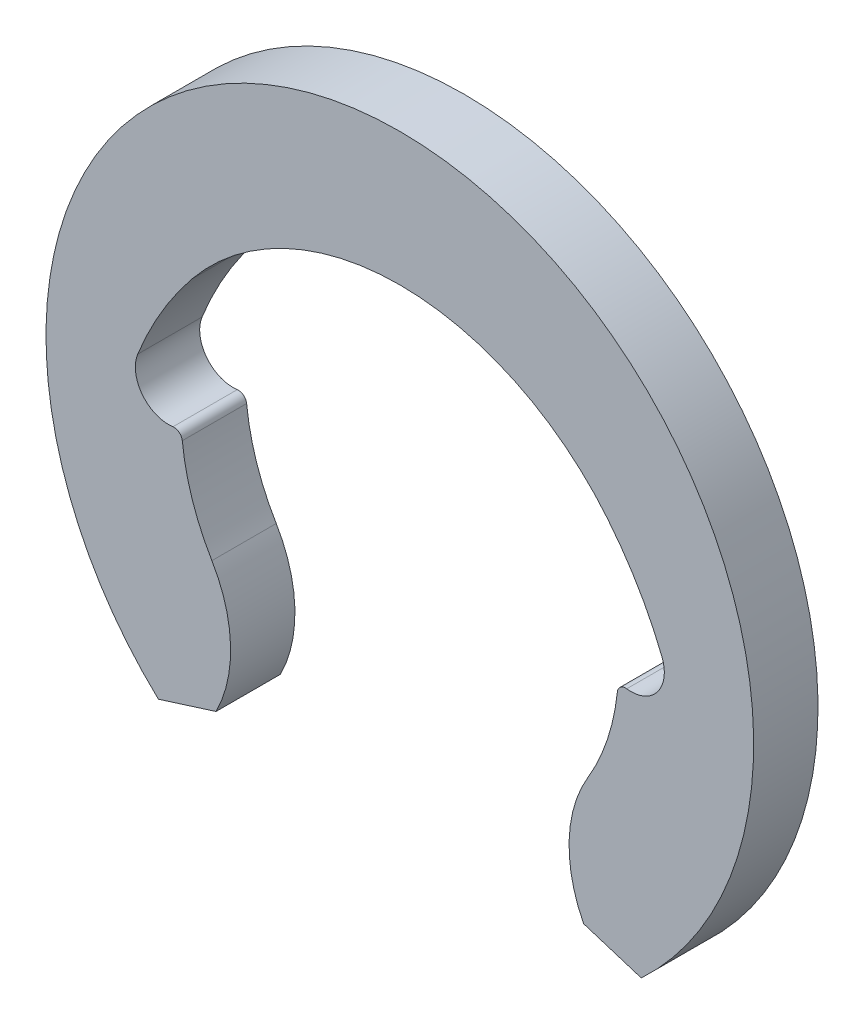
SolidWorks part; units mm, degrees
ref_plane "Front Plane" through (0, 0, 0) normal (0, 0, 1) x (1, 0, 0)
ref_plane "Top Plane" through (0, 0, 0) normal (0, 1, 0) x (1, 0, 0)
ref_plane "Right Plane" through (0, 0, 0) normal (1, 0, 0) x (0, 0, -1)
sketch "Sketch1" plane through (0, 0, 0) normal (0, 0, 1) x (1, 0, 0)
  line L0 (2.4748, 0) -> (-2.7989, 0) construction
  line L1 (0, 2.5848) -> (0, -2.932) construction
  line L2 (0, -0.2095) -> (0, 0.2095) construction
  line L3 (-1.0885, -1.4242) -> (-1.4299, -1.5318)
  line L4 (1.0885, -1.4242) -> (1.4299, -1.5318)
  arc A0 (-1.2883, -0.1352) -> (-1.113, -0.6628) centre (0, 0) ccw
  arc A1 (1.4299, -1.5318) -> (-1.4299, -1.5318) centre (0, 0) ccw
  arc A2 (-1.5524, 0.1766) -> (-1.3437, -0.0916) centre (-1.3696, 0.1036) ccw
  arc A3 (-1.5524, 0.1766) -> (-1.2303, 0.7238) centre (0.3937, -0.6004) cw
  arc A4 (1.5524, 0.1766) -> (1.2303, 0.7238) centre (-0.3937, -0.6004) ccw
  arc A5 (1.113, -0.6628) -> (1.2883, -0.1352) centre (0, 0) ccw
  arc A6 (-1.113, -0.6628) -> (-1.0885, -1.4242) centre (-1.7895, -1.0656) cw
  arc A7 (-1.2883, -0.1352) -> (-1.3437, -0.0916) centre (-1.3373, -0.1404) ccw
  arc A8 (1.113, -0.6628) -> (1.0885, -1.4242) centre (1.7895, -1.0656) ccw
  arc A9 (1.2883, -0.1352) -> (1.3437, -0.0916) centre (1.3373, -0.1404) cw
  arc A10 (1.5524, 0.1766) -> (1.3437, -0.0916) centre (1.3696, 0.1036) cw
  arc A11 (1.2303, 0.7238) -> (-1.2303, 0.7238) centre (0, -0.2794) ccw
  circle A12 centre (0, 0) radius 1.2954 construction
  dimension "D1" = 0.0492
  dimension "D2" = 2.0955
  dimension "D3" = 0.7874
  dimension "D4" = 0.1968
  dimension "Free_Outside_Dia" = 4.191
  dimension "Diameter" = 2.5908
  dimension "D5" = 2.7392
  dimension "D6" = 0.7874
  dimension "Shaft" = 3.175
  dimension "Large_Section" = 0.7874
  dimension "D7" = 3.5791
  dimension "D8" = 0.3579
  dimension "D9" = 145
extrude "Extrude1" add sketch "Sketch1" along normal mid plane 0.381
equation "\"D3@Sketch1\" = \"Large_Section@Sketch1\""
equation "\"D6@Sketch1\" = \"Large_Section@Sketch1\""
equation "\"D8@Sketch1\" = \"Large_Section@Sketch1\"/2.2"
equation "\"D7@Sketch1\" = 10*\"D8@Sketch1\""
equation "\"D4@Sketch1\" = \"Large_Section@Sketch1\"/4"
equation "\"D1@Sketch1\" = \"D4@Sketch1\"/4"
equation "\"D5@Sketch1\" = \"Free_Outside_Dia@Sketch1\"/1.53"
equation "\"D2@Sketch1\" = \"Free_Outside_Dia@Sketch1\"/2"
